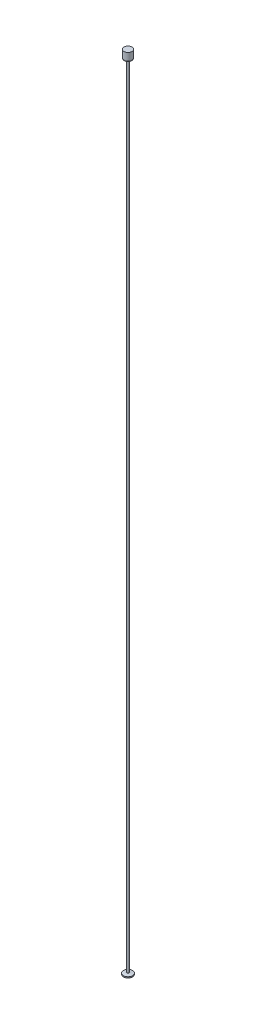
SolidWorks part; units mm, degrees
ref_plane "Płaszczyzna przednia" through (0, 0, 0) normal (0, 0, 1) x (1, 0, 0)
ref_plane "Płaszczyzna górna" through (0, 0, 0) normal (0, 1, 0) x (1, 0, 0)
ref_plane "Płaszczyzna prawa" through (0, 0, 0) normal (1, 0, 0) x (0, 0, -1)
sketch "Szkic1" plane through (0, 0, 0) normal (0, 1, 0) x (1, 0, 0)
  circle A0 centre (0, 0) radius 6.9
  dimension "D1" = 13.8
extrude "Dodanie-wyciągnięcie1" add sketch "Szkic1" along normal blind 2.5
chamfer "Sfazowanie1" distance 5 angle 10 1 edges at (0, 2.5, 6.9)
sketch "Szkic2" plane through (0, 2.5, 0) normal (0, 1, 0) x (1, 0, 0)
  circle A0 centre (0, 0) radius 1.5
  dimension "D1" = 3
extrude "Dodanie-wyciągnięcie2" add sketch "Szkic2" along normal blind 1200
sketch "Szkic3" plane through (0, 1202.5, 0) normal (0, 1, 0) x (1, 0, 0)
  circle A0 centre (0, 0) radius 6
  dimension "D1" = 12
extrude "Dodanie-wyciągnięcie3" add sketch "Szkic3" along normal blind 13 from offset 1 separate body
fillet "Zaokrąglenie1" radius 2 1 edges at (0, 1201.5, 6)
